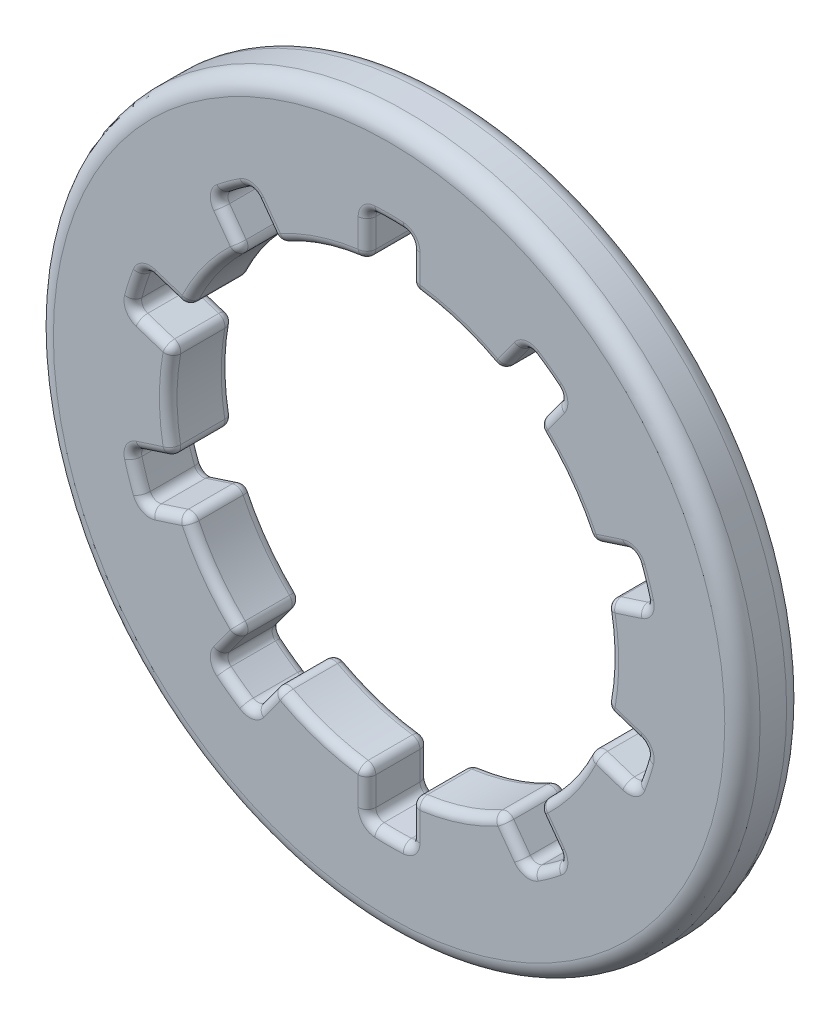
SolidWorks part; units mm, degrees
ref_plane "Plan1" through (0, 0, 0) normal (0, 0, 1) x (1, 0, 0)
ref_plane "Plan2" through (0, 0, 0) normal (0, 1, 0) x (1, 0, 0)
ref_plane "Plan3" through (0, 0, 0) normal (1, 0, 0) x (0, 0, -1)
sketch "Esquisse1" plane through (0, 0, 0) normal (0, 0, 1) x (1, 0, 0)
  circle A1 centre (0, 0) radius 4
  dimension "D1" = 8
extrude "Base-Extrusion" add sketch "Esquisse1" along normal blind 0.7
fillet "Congé1" radius 0.2
sketch "Esquisse2" plane through (0, 0, 0.7) normal (0, 0, 1) x (1, 0, 0)
  line L0 (-0.25, 2.8961) -> (-0.25, 2.4875)
  line L1 (0, 0.5369) -> (0, -0.5369) construction
  line L2 (0.25, 2.8961) -> (0.25, 2.4875)
  line L3 (0.25, -2.4875) -> (0.25, -2.8961)
  line L4 (-0.25, -2.4875) -> (-0.25, -2.8961)
  circle A0 centre (0, 0) radius 3 construction
  arc A1 (-0.25, 2.4875) -> (-0.25, -2.4875) centre (0, 0) ccw
  arc A2 (0.1552, 2.996) -> (-0.1552, 2.996) centre (0, 0) ccw
  arc A3 (-0.1552, -2.996) -> (0.1552, -2.996) centre (0, 0) ccw
  arc A4 (0.1552, 2.996) -> (0.25, 2.8961) centre (0.15, 2.8961) cw
  arc A5 (-0.25, 2.8961) -> (-0.1552, 2.996) centre (-0.15, 2.8961) cw
  arc A6 (-0.1552, -2.996) -> (-0.25, -2.8961) centre (-0.15, -2.8961) cw
  arc A7 (0.1552, -2.996) -> (0.25, -2.8961) centre (0.15, -2.8961) ccw
  arc A8 (0.25, -2.4875) -> (0.25, 2.4875) centre (0, 0) ccw
  point P12 (0.25, 2.9896)
  point P15 (-0.25, 2.9896)
  point P18 (-0.25, -2.9896)
  point P21 (0.25, -2.9896)
  dimension "D1" = 6
  dimension "D2" = 5
  dimension "D4" = 0.1
  dimension "D3" = 0.5
extrude "Enlèv. mat.-Extru.1" cut sketch "Esquisse2" against normal through all
pattern_circular "Répétition circulaire1" count 5 every 36
fillet "Congé2" radius 0.1
